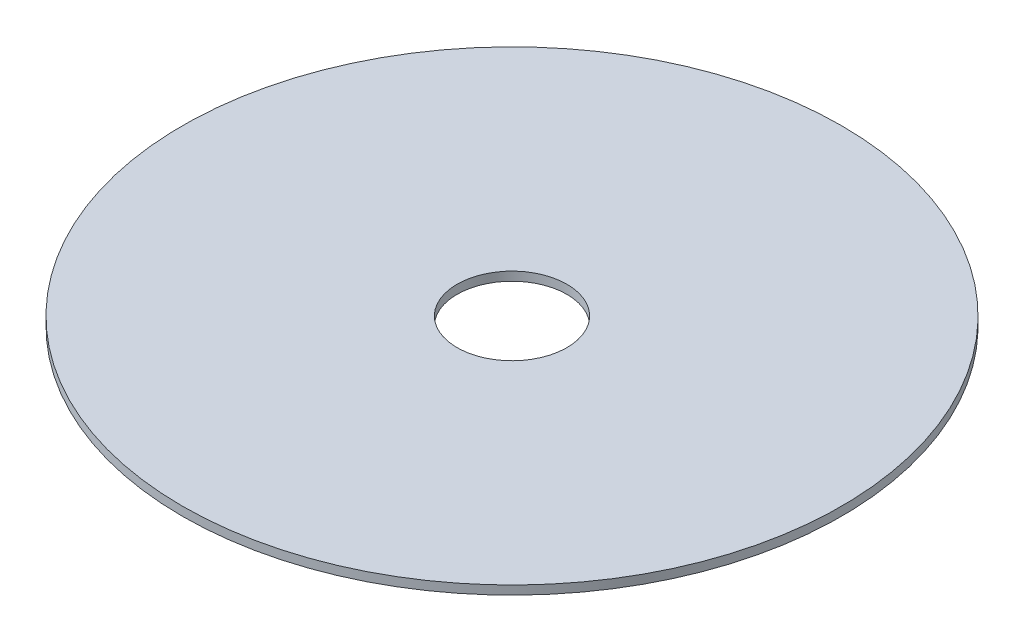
SolidWorks part; units mm, degrees
ref_plane "Front Plane" through (0, 0, 0) normal (0, 0, 1) x (1, 0, 0)
ref_plane "Top Plane" through (0, 0, 0) normal (0, 1, 0) x (1, 0, 0)
ref_plane "Right Plane" through (0, 0, 0) normal (1, 0, 0) x (0, 0, -1)
sketch "Sketch1" plane through (0, 0, 0) normal (0, 1, 0) x (1, 0, 0)
  circle A0 centre (0, 0) radius 28.575
  circle A1 centre (0, 0) radius 4.7625
  dimension "D1" = 9.525
  dimension "D2" = 57.15
extrude "Boss-Extrude1" add sketch "Sketch1" along normal blind 0.762 contours A0
